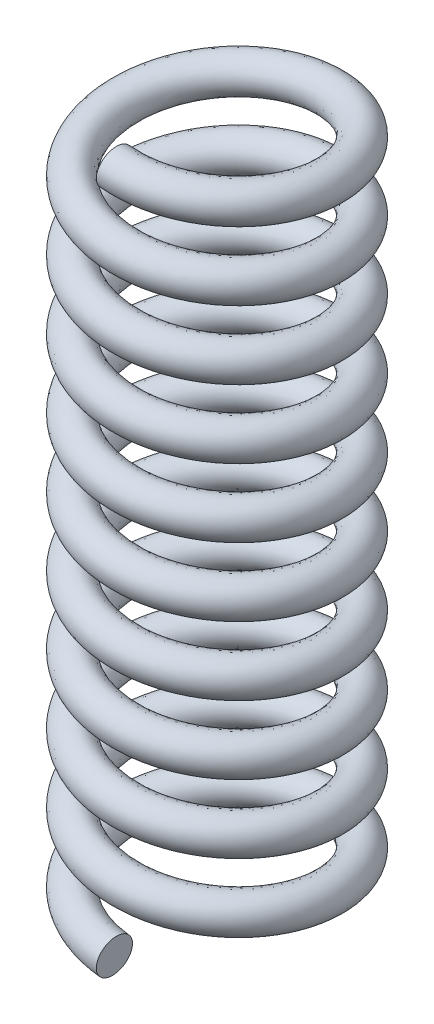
SolidWorks part; units mm, degrees
ref_plane "Front Plane" through (0, 0, 0) normal (0, 0, 1) x (1, 0, 0)
ref_plane "Top Plane" through (0, 0, 0) normal (0, 1, 0) x (1, 0, 0)
ref_plane "Right Plane" through (0, 0, 0) normal (1, 0, 0) x (0, 0, -1)
sketch "Sketch2" plane through (0, 0, 0) normal (0, 1, 0) x (1, 0, 0)
  circle A0 centre (0, 0) radius 28.5
  dimension "D1" = 57
curve "Helix/Spiral1"
ref_plane "Plane1" through (0, 0, 28.5) normal (-0.9944, 0.1055, 0) x (0, 0, 1)
sketch "Sketch3" plane through (0, 0, 28.5) normal (-0.9944, 0.1055, 0) x (0, 0, 1)
  circle A0 centre (0, 0) radius 5
  point P2 (0, 0)
  point P3 (0, 0)
  dimension "D1" = 10
sweep "Sweep1" add profiles "Sketch3" path "Helix/Spiral1"
